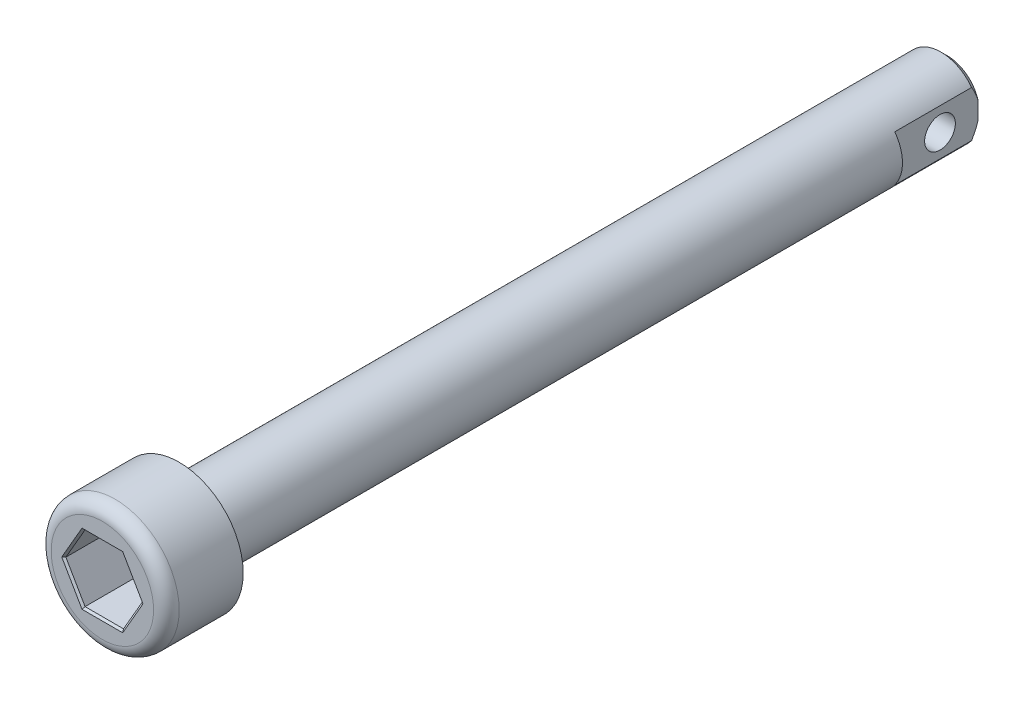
SolidWorks part; units mm, degrees
ref_plane "Plan1" through (0, 0, 0) normal (0, 0, 1) x (1, 0, 0)
ref_plane "Plan2" through (0, 0, 0) normal (0, 1, 0) x (1, 0, 0)
ref_plane "Plan3" through (0, 0, 0) normal (1, 0, 0) x (0, 0, -1)
sketch "Esquisse1" plane through (0, 0, 0) normal (0, 0, 1) x (1, 0, 0)
  circle A0 centre (0, 0) radius 5
extrude "Base-Extrusion" add sketch "Esquisse1" along normal blind 6
sketch "Esquisse3" plane through (0, 0, 6) normal (0, 0, 1) x (1, 0, 0)
  line L0 (-3, 0) -> (-1.5027, 2.5965)
  line L1 (-1.5027, 2.5965) -> (1.5027, 2.5965)
  line L2 (1.5027, 2.5965) -> (3, 0)
  line L3 (3, 0) -> (1.5027, -2.5965)
  line L4 (1.5027, -2.5965) -> (-1.5027, -2.5965)
  line L5 (-1.5027, -2.5965) -> (-3, 0)
extrude "Enlèv. mat.-Extru.1" cut sketch "Esquisse3" against normal blind 4
fillet "Congé1" radius 1
chamfer "Chanfrein3" distance 0.15 angle 45
sketch "Esquisse4" plane through (0, 0, 0) normal (0, 0, -1) x (-1, 0, 0)
  circle A0 centre (0, 0) radius 3
  dimension "D1" = 6
extrude "Boss.-Extru.1" add sketch "Esquisse4" along normal blind 60
chamfer "Chanfrein4" distance 0.5 angle 45
sketch "Esquisse5" plane through (0, 0, -60) normal (0, 0, -1) x (-1, 0, 0)
  line L0 (-4.1258, 3) -> (-2.4, 3)
  line L1 (-4.1258, 3) -> (-4.1258, -2.7465)
  line L2 (-2.4, -2.7465) -> (-4.1258, -2.7465)
  line L3 (-2.4, -2.7465) -> (-2.4, 3)
extrude "Enlèv. mat.-Extru.2" cut sketch "Esquisse5" against normal blind 6.5
sketch "Esquisse6" plane through (0, 0, -60) normal (0, 0, -1) x (-1, 0, 0)
  line L0 (2.4, 3) -> (4, 3)
  line L1 (2.4, 3) -> (2.4, -3)
  line L2 (4, -3) -> (2.4, -3)
  line L3 (4, -3) -> (4, 3)
  circle A0 centre (0, 0) radius 5 construction
  dimension "D1" = 2.4
extrude "Enlèv. mat.-Extru.3" cut sketch "Esquisse6" against normal blind 6.5
sketch "Esquisse7" plane through (2.4, 0, 0) normal (1, 0, 0) x (0, 0, -1)
  line L0 (59.5, 0) -> (60, 0) construction
  circle A0 centre (57.0304, 0) radius 1.2
extrude "Enlèv. mat.-Extru.4" cut sketch "Esquisse7" against normal through all
